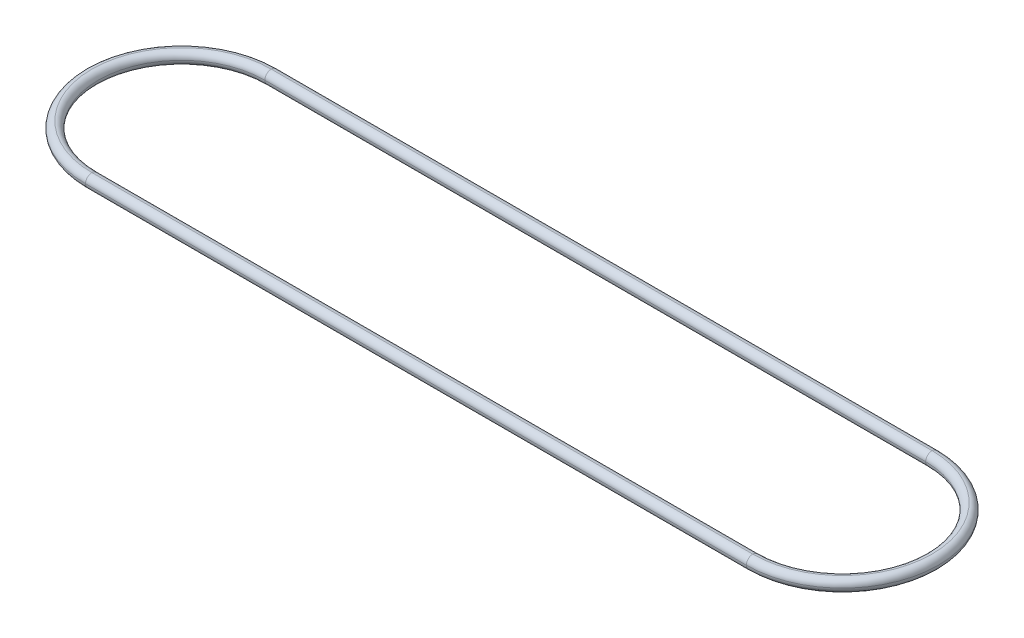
SolidWorks part; units mm, degrees
ref_plane "Plan de face" through (0, 0, 0) normal (0, 0, 1) x (1, 0, 0)
ref_plane "Plan de dessus" through (0, 0, 0) normal (0, 1, 0) x (1, 0, 0)
ref_plane "Plan de droite" through (0, 0, 0) normal (1, 0, 0) x (0, 0, -1)
sketch "Esquisse1" plane through (0, 0, 0) normal (0, 1, 0) x (1, 0, 0)
  line L0 (0, 37.5) -> (258, 37.5)
  line L2 (0, -37.5) -> (258, -37.5)
  line L4 (258, -32.5) -> (0, -32.5)
  line L6 (0, 32.5) -> (258, 32.5)
  arc A0 (0, 32.5) -> (0, -32.5) centre (0, 0) ccw
  arc A1 (258, -32.5) -> (258, 32.5) centre (258, 0) ccw
  arc A2 (0, 37.5) -> (0, -37.5) centre (0, 0) ccw
  arc A4 (258, -37.5) -> (258, 37.5) centre (258, 0) ccw
  dimension "D2" = 65
  dimension "D3" = 75
extrude "Extrusion1" add sketch "Esquisse1" along normal blind 5
fillet "Congé5" radius 2.5 24 edges at (295.5, 5, 0) (129, 5, -37.5) (290.5, 0, 0) (258, 2.5, 32.5) (129, 0, -32.5) (258, 2.5, -32.5) (-32.5, 0, 0) (0, 2.5, -32.5) (129, 0, 32.5) (0, 2.5, 32.5) (290.5, 5, 0) (129, 5, -32.5) (-32.5, 5, 0) (129, 5, 32.5) (-37.5, 5, 0) (129, 0, -37.5) (295.5, 0, 0) (129, 0, 37.5) (-37.5, 0, 0) (129, 5, 37.5) (0, 2.5, -37.5) (258, 2.5, -37.5) (258, 2.5, 37.5) (0, 2.5, 37.5)
